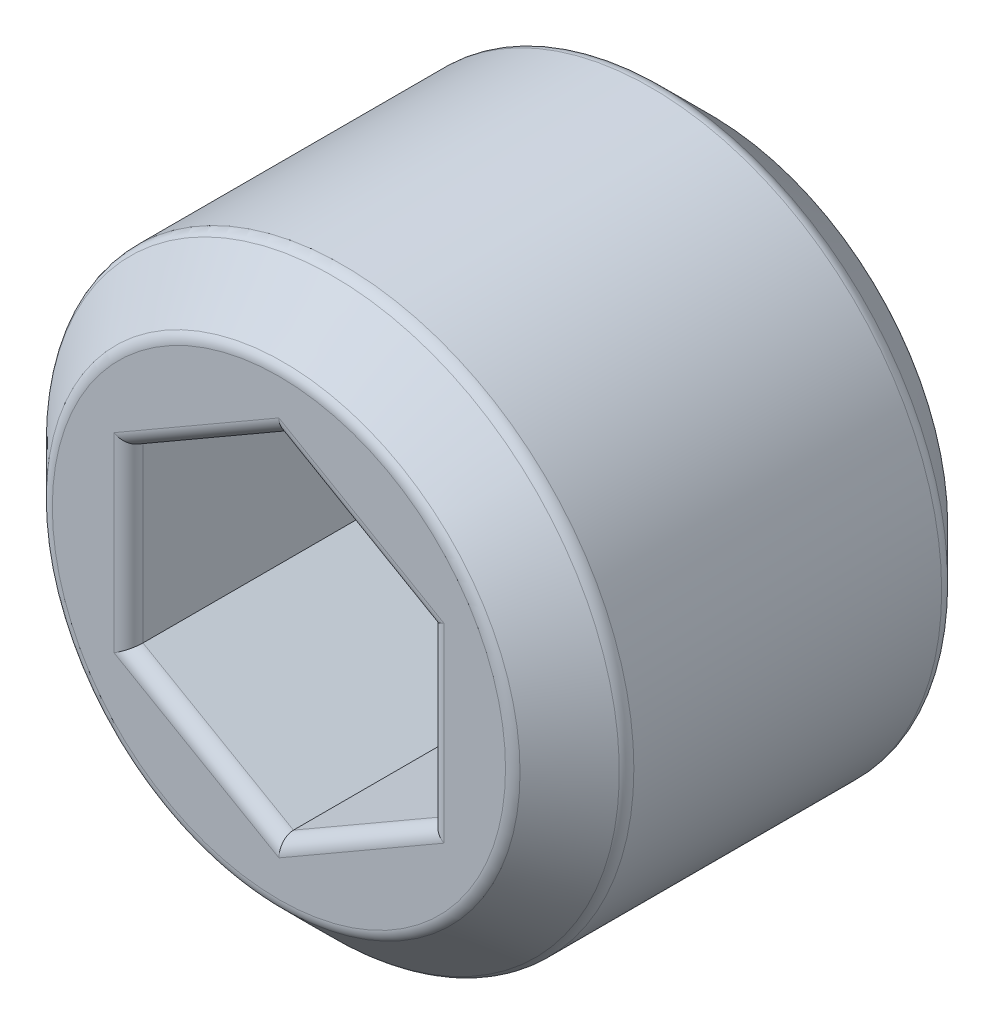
SolidWorks part; units mm, degrees
ref_plane "Plan1" through (0, 0, 0) normal (0, 0, 1) x (1, 0, 0)
ref_plane "Plan2" through (0, 0, 0) normal (0, 1, 0) x (1, 0, 0)
ref_plane "Plan3" through (0, 0, 0) normal (1, 0, 0) x (0, 0, -1)
sketch "Esquisse1" plane through (0, 0, 0) normal (0, 0, 1) x (1, 0, 0)
  circle A0 centre (0, 0) radius 2
  dimension "D1" = 4
extrude "Extrusion1" add sketch "Esquisse1" along normal blind 3
chamfer "Chanfrein1" distance 0.4 angle 45
sketch "Esquisse2" plane through (0, 0, 3) normal (0, 0, 1) x (1, 0, 0)
  line L1 (0, 1.1949) -> (-1.0348, 0.5975)
  line L2 (-1.0348, 0.5975) -> (-1.0348, -0.5975)
  line L3 (-1.0348, -0.5975) -> (0, -1.1949)
  line L4 (0, -1.1949) -> (1.0348, -0.5975)
  line L5 (1.0348, -0.5975) -> (1.0348, 0.5975)
  line L6 (1.0348, 0.5975) -> (0, 1.1949)
  circle A0 centre (0, 0) radius 1.0348 construction
extrude "Enlèv. mat.-Extru.1" cut sketch "Esquisse2" against normal blind 2
fillet "Congé1" radius 0.1
